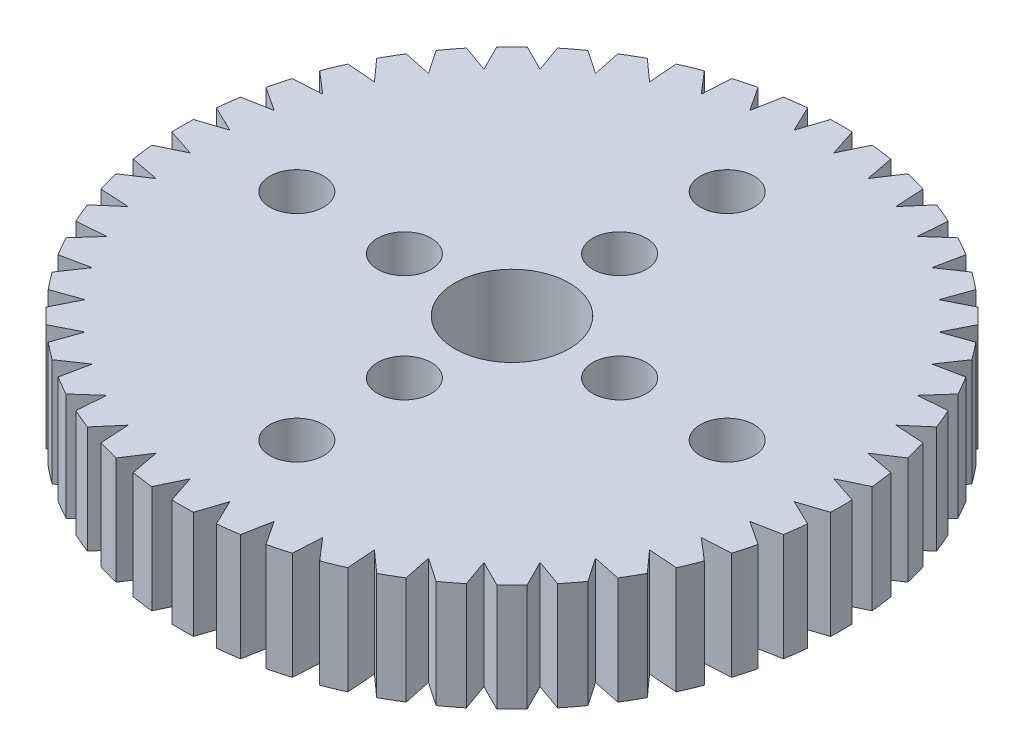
SolidWorks part; units mm, degrees
ref_plane "前视基准面" through (0, 0, 0) normal (0, 0, 1) x (1, 0, 0)
ref_plane "上视基准面" through (0, 0, 0) normal (0, 1, 0) x (1, 0, 0)
ref_plane "右视基准面" through (0, 0, 0) normal (1, 0, 0) x (0, 0, -1)
sketch "草图1" plane through (0, 0, 0) normal (0, 1, 0) x (1, 0, 0)
  line L5 (2.4014, 24.382) -> (1.4716, 22.4518)
  line L6 (3.9909, 24.1728) -> (4.3895, 22.0677)
  arc A2 (2.4014, 24.382) -> (3.9909, 24.1728) centre (0, 0) cw
  arc A3 (4.3895, 22.0677) -> (-4.3895, -22.0677) centre (0, 0) cw
  arc A5 (1.4716, 22.4518) -> (-4.3895, -22.0677) centre (0.0231, -0.003) ccw
  point P3 (4.3895, 22.0677)
  point P9 (1.4716, 22.4518)
extrude "凸台-拉伸1" add sketch "草图1" along normal blind 8
pattern_circular "阵列(圆周)1" count 48 over 360 about axis through (0, 0, 0) along (0, 1, 0) of "凸台-拉伸1"
sketch "草图2" plane through (0, 0, 0) normal (0, 1, 0) x (1, 0, 0)
  circle A0 centre (0, 0) radius 4.25
extrude "切除-拉伸2" cut sketch "草图2" along normal blind 13
sketch "草图3" plane through (0, 0, 0) normal (0, -1, 0) x (-1, 0, 0)
  circle A6 centre (8, 0) radius 2
  circle A8 centre (0, 0) radius 2
  circle A9 centre (16, 0) radius 2
  circle A10 centre (-8, 0) radius 2
  circle A11 centre (-16, 0) radius 2
  circle A12 centre (0, 8) radius 2
  circle A13 centre (0, 16) radius 2
  circle A14 centre (0, -16) radius 2
  circle A15 centre (0, -8) radius 2
  point P0 (0, 0)
  dimension "D1" = 8
  dimension "D2" = 2
  dimension "D3" = 2
  dimension "D4" = 2
  dimension "D5" = 2
  dimension "D6" = 2
  dimension "D7" = 2
extrude "切除-拉伸3" cut sketch "草图3" against normal blind 13
equation "\"度7.5度\"=360"
equation "\"度3.75度\"=15"
